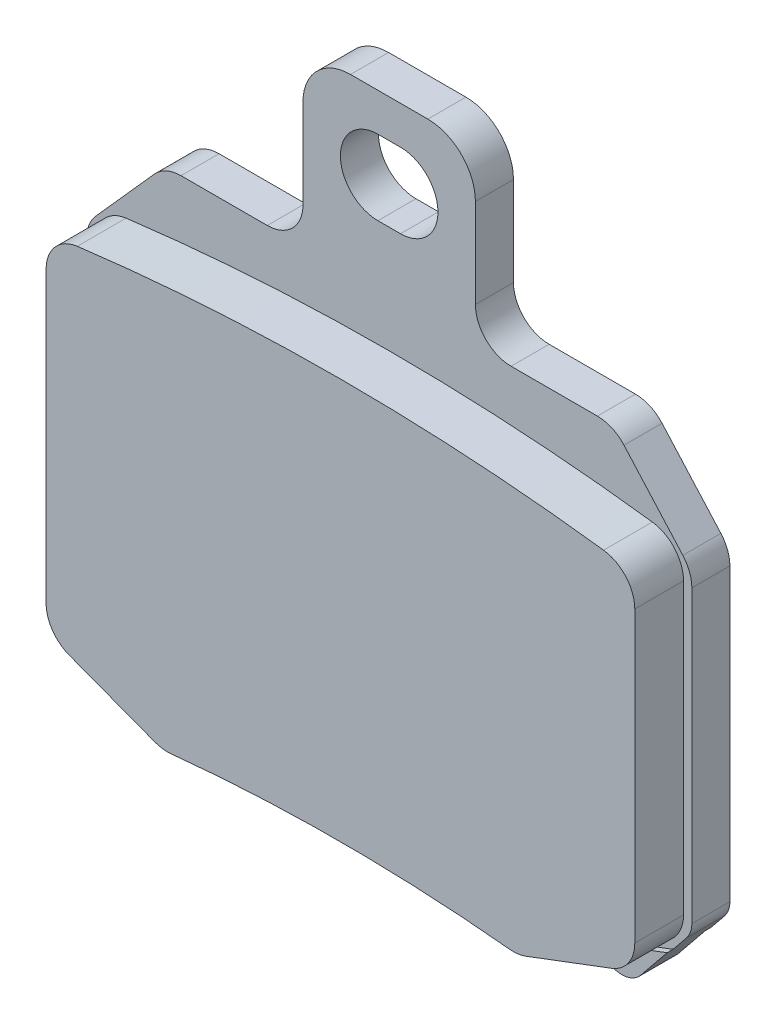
SolidWorks part; units mm, degrees
ref_plane "正面" through (0, 0, 0) normal (0, 0, 1) x (1, 0, 0)
ref_plane "平面" through (0, 0, 0) normal (0, 1, 0) x (1, 0, 0)
ref_plane "右側面" through (0, 0, 0) normal (1, 0, 0) x (0, 0, -1)
sketch "ｽｹｯﾁ1" plane through (0, 0, 0) normal (0, 0, 1) x (1, 0, 0)
  line L0 (-212.5476, 2170.2353) -> (-933.7157, 2204.2448) construction
  line L1 (-59.365, -50.7247) -> (-56.5646, 149.2557) construction
  line L2 (0, -48.2) -> (0, -14.5)
  line L3 (0, -14.5) -> (18.2, -14.5)
  line L4 (18.2, -14.5) -> (18.2, 0)
  line L5 (18.2, 0) -> (32.7, 0)
  line L6 (25.45, 0) -> (25.45, -52.7) construction
  line L8 (32.7, -14.5) -> (32.7, 0)
  line L9 (50.9, -14.5) -> (32.7, -14.5)
  line L10 (50.9, -48.2) -> (50.9, -14.5)
  line L11 (0, -48.2) -> (4.55, -53.8188)
  line L12 (4.55, -53.8188) -> (9.1781, -53.0194)
  line L13 (9.1781, -53.0194) -> (10.45, -53.5)
  line L14 (50.9, -48.2) -> (46.35, -53.8188)
  line L15 (46.35, -53.8188) -> (41.7219, -53.0194)
  line L16 (41.7219, -53.0194) -> (40.45, -53.5)
  arc A0 (10.45, -53.5) -> (40.45, -53.5) centre (25.45, -193.725) cw
  dimension "D1" = 200
  dimension "D2" = 14.5
  dimension "D3" = 14.5
  dimension "D4" = 50.9
  dimension "D5" = 33.7
  dimension "D6" = 141
  dimension "D7" = 119.2
  dimension "D8" = 20.9
  dimension "D9" = 15
  dimension "D10" = 39
  dimension "D11" = 38.2
  dimension "D12" = 149.5
extrude "ﾎﾞｽ - 押し出し1" add sketch "ｽｹｯﾁ1" along normal blind 3.2
hole_wizard "Ø6.3 (6.3) 直径のｽﾛｯﾄ1" positions "ｽｹｯﾁ2" profile "ｽｹｯﾁ3" size "Ø6.3" standard "JIS"
sketch "ｽｹｯﾁ2" plane through (0, 0, 3.2) normal (0, 0, 1) x (1, 0, 0)
  line L0 (21.35, -6.35) -> (29.55, -6.35) construction
  line L1 (25.45, 0) -> (25.45, -6.35) construction
  line L2 (32.7, 0) -> (18.2, 0) construction
  point P0 (25.45, -6.35)
  dimension "D1" = 8.2
  dimension "D2" = 6.35
sketch "ｽｹｯﾁ3" plane through (25.45, -6.35, 3.2) normal (1, 0, 0) x (0, -1, 0)
  line L0 (0, 0) -> (0, 3.2)
  line L1 (0, 3.2) -> (3.15, 3.2)
  line L2 (3.15, 3.2) -> (3.15, 0)
  line L5 (3.15, 0) -> (0, 0)
  line L11 (0, -6.35) -> (0, 107.95) construction
  dimension "通し穴の直径" = 6.3
  dimension "通し穴の深さ" = 3.2
sketch "ｽｹｯﾁ7" plane through (0, 0, 0) normal (0, 0, -1) x (-1, 0, 0)
  line L0 (-25.45, 0) -> (-25.45, -15.3902) construction
  line L1 (-32.7, 0) -> (-18.2, 0) construction
  line L2 (-18.2, -14.5) -> (0, -14.5) construction
  circle A0 centre (-33.85, -35.1) radius 3.9
  circle A1 centre (-17.05, -35.1) radius 3.9
  dimension "D1" = 7.8
  dimension "D2" = 16.8
  dimension "D3" = 20.6
extrude "ｶｯﾄ - 押し出し1" cut sketch "ｽｹｯﾁ7" against normal blind 1
sketch "ｽｹｯﾁ8" plane through (0, 0, 3.2) normal (0, 0, 1) x (1, 0, 0)
  line L0 (0.7, -20.2567) -> (0.7, -49.2813)
  line L1 (0.7, -49.2813) -> (10.5154, -52.9902)
  line L2 (25.45, 0) -> (25.45, -56.6423) construction
  line L3 (32.7, 0) -> (18.2, 0) construction
  line L4 (50.2, -20.2567) -> (50.2, -49.2813)
  line L5 (50.2, -49.2813) -> (40.3846, -52.9902)
  line L6 (9.1781, -53.0194) -> (10.45, -53.5) construction
  line L7 (25.45, -18.5) -> (12.3312, -18.5) construction
  arc A0 (40.3846, -52.9902) -> (10.5154, -52.9902) centre (25.45, -193.725) ccw
  arc A1 (50.2, -20.2567) -> (0.7, -20.2567) centre (25.45, -193.725) ccw
  arc A2 (40.45, -53.5) -> (10.45, -53.5) centre (25.45, -193.725) ccw construction
  dimension "D2" = 0.5
  dimension "D1" = 49.5
  dimension "D3" = 0.5
  dimension "D4" = 18.5
extrude "ﾎﾞｽ - 押し出し2" add sketch "ｽｹｯﾁ8" along normal blind 4.1
fillet "ﾌｨﾚｯﾄ1" radius 3 2 edges at (32.7, -14.5, 1.6) (18.2, -14.5, 1.6)
fillet "ﾌｨﾚｯﾄ2" radius 4 2 edges at (32.7, 0, 1.6) (18.2, 0, 1.6)
fillet "ﾌｨﾚｯﾄ3" radius 3 2 edges at (50.2, -20.2567, 5.25) (0.7, -20.2567, 5.25)
fillet "ﾌｨﾚｯﾄ4" radius 3 4 edges at (50.2, -49.2813, 5.25) (40.3846, -52.9902, 5.25) (10.5154, -52.9902, 5.25) (0.7, -49.2813, 5.25)
sketch "ｽｹｯﾁ9" plane through (0, 0, 0) normal (0, 0, -1) x (-1, 0, 0)
  line L0 (-6.6, -14.5) -> (0, -21.9)
  line L1 (0, -21.9) -> (0, -14.5)
  line L2 (0, -14.5) -> (-6.6, -14.5)
  line L3 (0, -48.2) -> (0, -14.5) construction
  line L4 (-15.2, -14.5) -> (0, -14.5) construction
  line L5 (0, -14.5) -> (-18.2, -14.5) construction
  line L6 (-25.45, 0) -> (-25.45, -65.3539) construction
  line L7 (-18.2, 0) -> (-32.7, 0) construction
  line L8 (-50.9, -14.5) -> (-44.3, -14.5)
  line L9 (-50.9, -21.9) -> (-50.9, -14.5)
  line L10 (-44.3, -14.5) -> (-50.9, -21.9)
  dimension "D1" = 6.6
  dimension "D2" = 7.4
extrude "ｶｯﾄ - 押し出し2" cut sketch "ｽｹｯﾁ9" against normal through all
fillet "ﾌｨﾚｯﾄ5" radius 3 4 edges at (50.9, -21.9, 1.6) (44.3, -14.5, 1.6) (0, -21.9, 1.6) (6.6, -14.5, 1.6)
fillet "ﾌｨﾚｯﾄ6" radius 2 8 edges at (0, -48.2, 1.6) (4.55, -53.8188, 1.6) (9.1781, -53.0194, 1.6) (10.45, -53.5, 1.6) (40.45, -53.5, 1.6) (41.7219, -53.0194, 1.6) (46.35, -53.8188, 1.6) (50.9, -48.2, 1.6)
sketch "ｽｹｯﾁ10" plane through (0, 0, 3.2) normal (0, 0, 1) x (1, 0, 0)
  line L0 (41.2119, -53.2121) -> (49.3233, -50.1471)
  line L1 (40.8941, -53.3322) -> (41.2119, -53.2121) construction
  line L2 (42.2592, -53.1122) -> (45.1937, -53.6191)
  line L3 (42.2592, -53.1122) -> (45.1937, -53.6191) construction
  line L4 (47.0884, -52.9069) -> (49.3233, -50.1471)
  line L5 (47.0884, -52.9069) -> (50.4543, -48.7504) construction
  line L6 (25.45, 0) -> (25.45, -58.1567) construction
  line L7 (28.7, 0) -> (22.2, 0) construction
  line L8 (3.8116, -52.9069) -> (1.5767, -50.1471)
  line L9 (8.6408, -53.1122) -> (5.7063, -53.6191)
  line L10 (9.6881, -53.2121) -> (1.5767, -50.1471)
  arc A0 (42.2592, -53.1122) -> (41.2119, -53.2121) centre (41.9188, -55.083) ccw construction
  arc A1 (41.2119, -53.2121) -> (42.2592, -53.1122) centre (41.9188, -55.083) cw
  arc A2 (45.1937, -53.6191) -> (47.0884, -52.9069) centre (45.5341, -51.6482) ccw
  arc A3 (45.1937, -53.6191) -> (47.0884, -52.9069) centre (45.5341, -51.6482) ccw construction
  arc A4 (5.7063, -53.6191) -> (3.8116, -52.9069) centre (5.3659, -51.6482) cw
  arc A5 (9.6881, -53.2121) -> (8.6408, -53.1122) centre (8.9812, -55.083) ccw
extrude "ﾎﾞｽ - 押し出し3" add sketch "ｽｹｯﾁ10" along normal blind 0.5
sketch "ｽｹｯﾁ11" plane through (0, 0, 0) normal (0, 0, -1) x (-1, 0, 0)
  line L3 (-49.3233, -50.1471) -> (-47.0884, -52.9069)
  line L4 (-41.2119, -53.2121) -> (-49.3233, -50.1471)
  line L5 (-45.1937, -53.6191) -> (-42.2592, -53.1122)
  line L6 (-49.3233, -50.1471) -> (-47.0884, -52.9069)
  line L7 (-41.2119, -53.2121) -> (-49.3233, -50.1471)
  line L8 (-45.1937, -53.6191) -> (-42.2592, -53.1122)
  line L9 (-8.6408, -53.1122) -> (-5.7063, -53.6191)
  line L10 (-1.5767, -50.1471) -> (-9.6881, -53.2121)
  line L11 (-3.8116, -52.9069) -> (-1.5767, -50.1471)
  line L12 (-8.6408, -53.1122) -> (-5.7063, -53.6191)
  line L13 (-1.5767, -50.1471) -> (-9.6881, -53.2121)
  line L14 (-3.8116, -52.9069) -> (-1.5767, -50.1471)
  arc A2 (-47.0884, -52.9069) -> (-45.1937, -53.6191) centre (-45.5341, -51.6482) ccw
  arc A3 (-41.2119, -53.2121) -> (-42.2592, -53.1122) centre (-41.9188, -55.083) ccw
  arc A4 (-47.0884, -52.9069) -> (-45.1937, -53.6191) centre (-45.5341, -51.6482) ccw
  arc A5 (-41.2119, -53.2121) -> (-42.2592, -53.1122) centre (-41.9188, -55.083) ccw
  arc A6 (-5.7063, -53.6191) -> (-3.8116, -52.9069) centre (-5.3659, -51.6482) ccw
  arc A7 (-8.6408, -53.1122) -> (-9.6881, -53.2121) centre (-8.9812, -55.083) ccw
  arc A8 (-5.7063, -53.6191) -> (-3.8116, -52.9069) centre (-5.3659, -51.6482) ccw
  arc A9 (-8.6408, -53.1122) -> (-9.6881, -53.2121) centre (-8.9812, -55.083) ccw
  dimension "D1" = 0
  dimension "D2" = 0
extrude "ｶｯﾄ - 押し出し3" cut sketch "ｽｹｯﾁ11" against normal blind 0.5
ref_plane "平面1" through (25.45, 0, 0) normal (-1, 0, 0) x (0, 0, 1)
